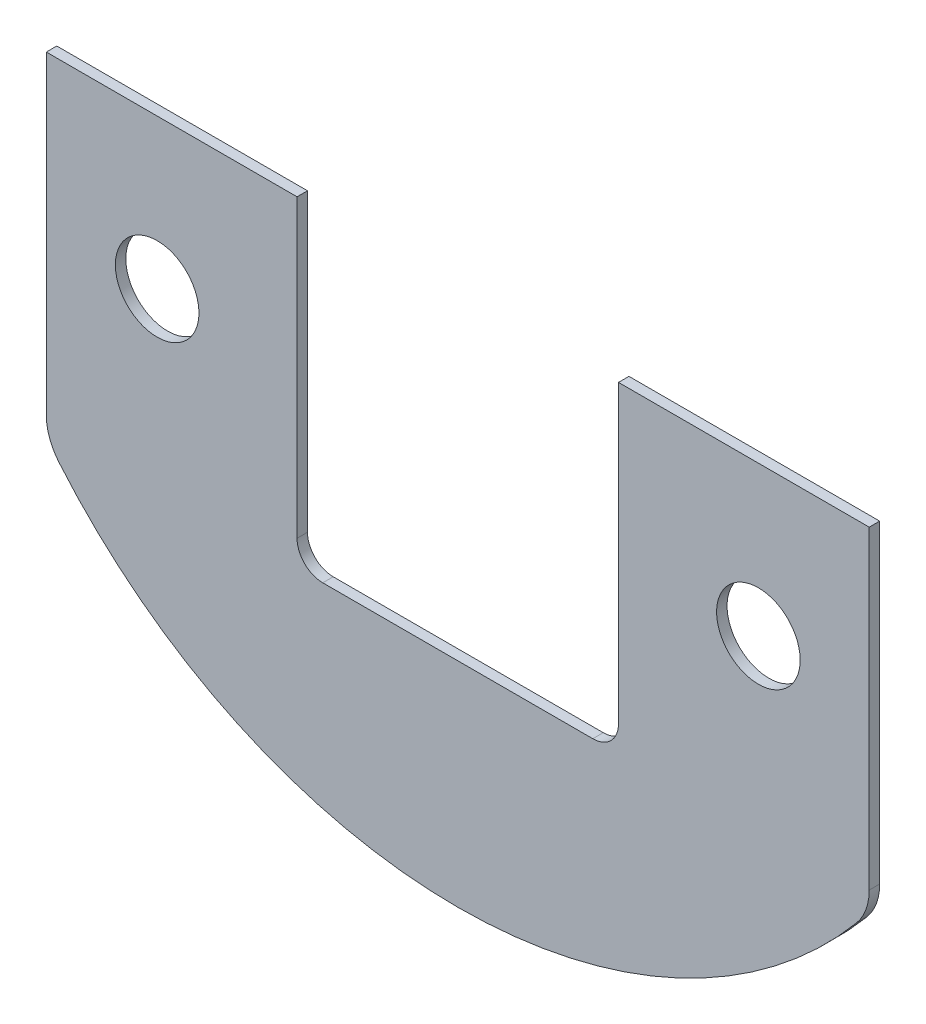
SolidWorks part; units mm, degrees
ref_plane "Front Plane" through (0, 0, 0) normal (0, 0, 1) x (1, 0, 0)
ref_plane "Top Plane" through (0, 0, 0) normal (0, 1, 0) x (1, 0, 0)
ref_plane "Right Plane" through (0, 0, 0) normal (1, 0, 0) x (0, 0, -1)
sketch "Sketch1" plane through (0, 0, 0) normal (0, 0, 1) x (1, 0, 0)
  line L2 (12.5, 0) -> (12.5, -25)
  line L3 (12.5, -25) -> (-12.5, -25)
  line L5 (-12.5, -25) -> (-12.5, 0)
  line L6 (0, 0) -> (0, -1.104) construction
  line L8 (-12.5, 0) -> (-32, 0)
  line L10 (32, 0) -> (12.5, 0)
  line L11 (0, -1.104) -> (0, -25) construction
  line L23 (-32, 0) -> (-32, -24.4463)
  line L24 (32, -24.4463) -> (32, 0)
  arc A9 (-32, -24.4463) -> (-31.0167, -27.1465) centre (-27.8008, -24.4463) ccw
  arc A10 (-31.0167, -27.1465) -> (31.0167, -27.1465) centre (0, -1.104) ccw
  arc A11 (31.0167, -27.1465) -> (32, -24.4463) centre (27.8008, -24.4463) ccw
extrude "Boss-Extrude1" add sketch "Sketch1" along normal blind 0.8128 contours L8 L23 A9 A10 A11 L24 L10 L2 L3 L5
fillet "Fillet1" radius 2 2 edges at (12.5, -25, 0.4064) (-12.5, -25, 0.4064)
sketch "Sketch2" plane through (0, 0, 0.8128) normal (0, 0, 1) x (1, 0, 0)
  line L0 (32, 0) -> (12.5, 0) construction
  line L1 (0, 0) -> (0, -25) construction
  line L2 (10.5, -25) -> (-10.5, -25) construction
  circle A1 centre (-23.3811, -11.643) radius 3.25
  circle A3 centre (23.3811, -11.643) radius 3.25
  dimension "D4" = 6.5
  dimension "D1" = 11.643
  dimension "D2" = 46.7622
  dimension "D3" = 23.3811
extrude "Cut-Extrude1" cut sketch "Sketch2" against normal through all
equation "\"D7@Sketch1\"=\"D6@Sketch1\"/2"
